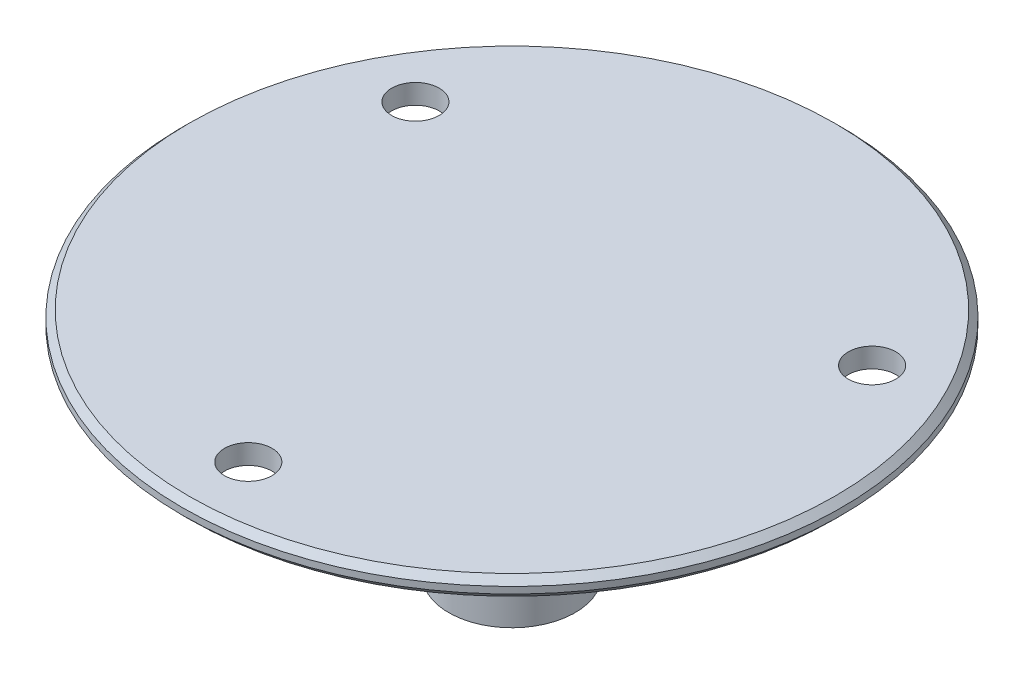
SolidWorks part; units mm, degrees
ref_plane "Front Plane" through (0, 0, 0) normal (0, 0, 1) x (1, 0, 0)
ref_plane "Top Plane" through (0, 0, 0) normal (0, 1, 0) x (1, 0, 0)
ref_plane "Right Plane" through (0, 0, 0) normal (1, 0, 0) x (0, 0, -1)
sketch "Sketch1" plane through (0, 0, 0) normal (0, 1, 0) x (1, 0, 0)
  circle A0 centre (0, 0) radius 25
  dimension "D1" = 50
extrude "Boss-Extrude1" add sketch "Sketch1" along normal blind 1.5
sketch "Sketch2" plane through (0, 0, 0) normal (0, -1, 0) x (1, 0, 0)
  line L1 (-2.1915, 2.4) -> (2.1915, 2.4) construction
  line L2 (-2.1915, 2.4) -> (-2.1915, -2.4) construction
  line L3 (-2.1915, -2.4) -> (2.1915, -2.4) construction
  line L4 (2.1915, 2.4) -> (2.1915, -2.4) construction
  line L5 (-2.7115, 3.9) -> (2.7115, 3.9) construction
  line L6 (-2.7115, 3.9) -> (-2.7115, -3.9) construction
  line L7 (-2.7115, -3.9) -> (2.7115, -3.9) construction
  line L8 (2.7115, 3.9) -> (2.7115, -3.9) construction
  arc A0 (-2.1915, 2.4) -> (-2.1915, -2.4) centre (0, 0) ccw construction
  arc A1 (-2.7115, 3.9) -> (-2.7115, -3.9) centre (0, 0) ccw construction
  arc A2 (2.1915, -2.4) -> (2.1915, 2.4) centre (0, 0) ccw construction
  arc A3 (2.7115, -3.9) -> (2.7115, 3.9) centre (0, 0) ccw construction
  circle A4 centre (0, 0) radius 3.3
  circle A5 centre (0, 0) radius 4.8
  dimension "D1" = 6.5
  dimension "D2" = 1.5
  dimension "D5" = 6.6
  dimension "D6" = 1.5
  dimension "D3" = 4.8
  dimension "D4" = 1.5
extrude "Boss-Extrude2" add sketch "Sketch2" along normal blind 16
sketch "Sketch3" plane through (0, 0, 0) normal (0, -1, 0) x (1, 0, 0)
  line L0 (0, 0) -> (0, 20) construction
  circle A0 centre (0, 0) radius 20 construction
  circle A1 centre (0, 20) radius 1.8
  circle A2 centre (17.3205, -10) radius 1.8
  circle A3 centre (-17.3205, -10) radius 1.8
  point P15 (0, 0)
  dimension "D1" = 40
  dimension "D2" = 3.6
  dimension "D3" = 3
extrude "Cut-Extrude1" cut sketch "Sketch3" against normal up to next
sketch "Sketch4" plane through (0, 0, 0) normal (0, 0, 1) x (1, 0, 0)
  line L0 (0, 0) -> (0, -11.5) construction
  line L1 (-4.8, -16) -> (4.8, -16) construction
  line L2 (0, -9) -> (0, -14) construction
  line L3 (0, -9) -> (-1.2465, -10.344)
  line L4 (0, -9) -> (1.2465, -10.344)
  line L5 (0, -14) -> (1.2465, -12.656)
  line L6 (0, -14) -> (-1.2465, -12.656)
  arc A0 (-1.2465, -10.344) -> (-1.2465, -12.656) centre (0, -11.5) ccw
  arc A1 (1.2465, -12.656) -> (1.2465, -10.344) centre (0, -11.5) ccw
  point P9 (0, -11.5)
  dimension "D1" = 3.4
  dimension "D2" = 4.5
  dimension "D3" = 5
extrude "Cut-Extrude2" cut sketch "Sketch4" against normal through all both and the other way through all
chamfer "Chamfer1" distance 0.5 angle 45 1 edges at (0, -16, -3.3)
chamfer "Chamfer2" distance 0.5 angle 45 1 edges at (0, 0, 25)
sketch "Sketch5" plane through (0, 0, 0) normal (0, -1, 0) x (1, 0, 0)
  line L1 (-3, 21.7321) -> (-3, 18.2679)
  line L2 (-3, 18.2679) -> (0, 16.5359)
  line L3 (0, 16.5359) -> (3, 18.2679)
  line L4 (3, 18.2679) -> (3, 21.7321)
  line L5 (3, 21.7321) -> (0, 23.4641)
  line L6 (0, 23.4641) -> (-3, 21.7321)
  line L7 (-17.3205, -6.5359) -> (-20.3205, -8.2679)
  line L8 (-20.3205, -8.2679) -> (-20.3205, -11.7321)
  line L9 (-20.3205, -11.7321) -> (-17.3205, -13.4641)
  line L10 (-17.3205, -13.4641) -> (-14.3205, -11.7321)
  line L11 (-14.3205, -11.7321) -> (-14.3205, -8.2679)
  line L12 (-14.3205, -8.2679) -> (-17.3205, -6.5359)
  line L13 (17.3205, -6.5359) -> (14.3205, -8.2679)
  line L14 (14.3205, -8.2679) -> (14.3205, -11.7321)
  line L15 (14.3205, -11.7321) -> (17.3205, -13.4641)
  line L16 (17.3205, -13.4641) -> (20.3205, -11.7321)
  line L17 (20.3205, -11.7321) -> (20.3205, -8.2679)
  line L18 (20.3205, -8.2679) -> (17.3205, -6.5359)
  circle A0 centre (0, 20) radius 3 construction
  circle A1 centre (-17.3205, -10) radius 3 construction
  circle A2 centre (17.3205, -10) radius 3 construction
  point P19 (0, 23.1822)
  dimension "D1" = 6
extrude "Cut-Extrude3" [suppressed] cut sketch "Sketch5" against normal blind 0.5
chamfer "Chamfer3" distance 0.5 angle 45 1 edges at (0, 1.5, 25)
